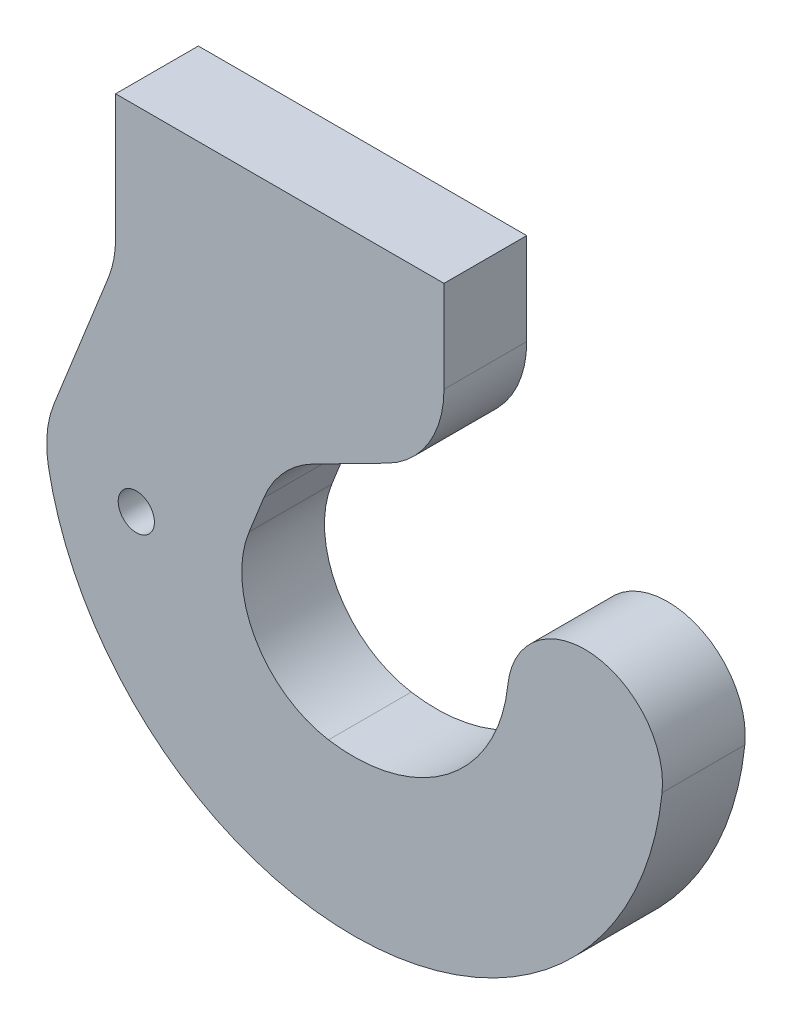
SolidWorks part; units mm, degrees
ref_plane "Front Plane" through (0, 0, 0) normal (0, 0, 1) x (1, 0, 0)
ref_plane "Top Plane" through (0, 0, 0) normal (0, 1, 0) x (1, 0, 0)
ref_plane "Right Plane" through (0, 0, 0) normal (1, 0, 0) x (0, 0, -1)
sketch "Sketch2" plane through (0, 0, 5) normal (0, 0, -1) x (-1, 0, 0)
  line L0 (-9.75, 30) -> (53.9867, 30) construction
  line L1 (-9.75, 22.5) -> (-9.75, 37.5) construction
  line L2 (-8.75, 29) -> (23, 29)
  line L3 (7.2829, 5.818) -> (-8.75, 14)
  line L4 (25, 50) -> (25, 33.0157) construction
  line L5 (23, 29) -> (23, 15)
  line L6 (29.6433, 20) -> (26.7573, 20) construction
  line L7 (-8.75, 29) -> (-8.75, 14)
  line L9 (-9.75, 22.5) -> (-9.75, 37.5) construction
  line L10 (29.9093, -2.3306) -> (23, 15)
  line L11 (12.7516, -7.8991) -> (7.2829, 5.818)
  line L12 (13.1891, -8.9966) -> (7.2829, 5.818) construction
  line L15 (7.2829, 5.818) -> (7.2829, 5.818) construction
  line L16 (7.2829, 5.818) -> (7.2829, 5.818) construction
  line L17 (7.2829, 5.818) -> (7.2829, 5.818) construction
  arc A0 (-29.9093, -2.3306) -> (29.9093, -2.3306) centre (0, 0) ccw construction
  arc A1 (-29.8386, -3.1074) -> (29.9093, -2.3306) centre (0, 0) ccw
  arc A2 (-14.9193, -1.5537) -> (12.7516, -7.8991) centre (0, 0) ccw
  arc A3 (-14.9193, -1.5537) -> (-29.8386, -3.1074) centre (-22.379, -2.3306) ccw
  arc A4 (-14.9547, -1.1653) -> (14.9547, -1.1653) centre (0, 0) ccw construction
  arc A5 (-29.9093, -2.3306) -> (29.9093, -2.3306) centre (0, 0) ccw construction
  point P19 (0, 0)
  point P29 (0, 0)
  dimension "D1" = 2
  dimension "D2" = 2
  dimension "D3" = 5
  dimension "D4" = 1
  dimension "D5" = 15
  dimension "D7" = 18
  dimension "D6" = 15
extrude "Boss-Extrude1" add sketch "Sketch2" along normal mid plane 8
fillet "Fillet1" radius 10 5 edges at (-23, 15, 5) (-29.9093, -2.3306, 5) (8.75, 14, 5) (-7.2829, 5.818, 5) (-12.7516, -7.8991, 5)
sketch "Sketch3" plane through (0, 0, 9) normal (0, 0, 1) x (1, 0, 0)
  circle A0 centre (-21, -5) radius 1.75
  dimension "D1" = 3.5
  dimension "D2" = 21
  dimension "D3" = 5
extrude "Cut-Extrude1" cut sketch "Sketch3" against normal through all both and the other way through all
